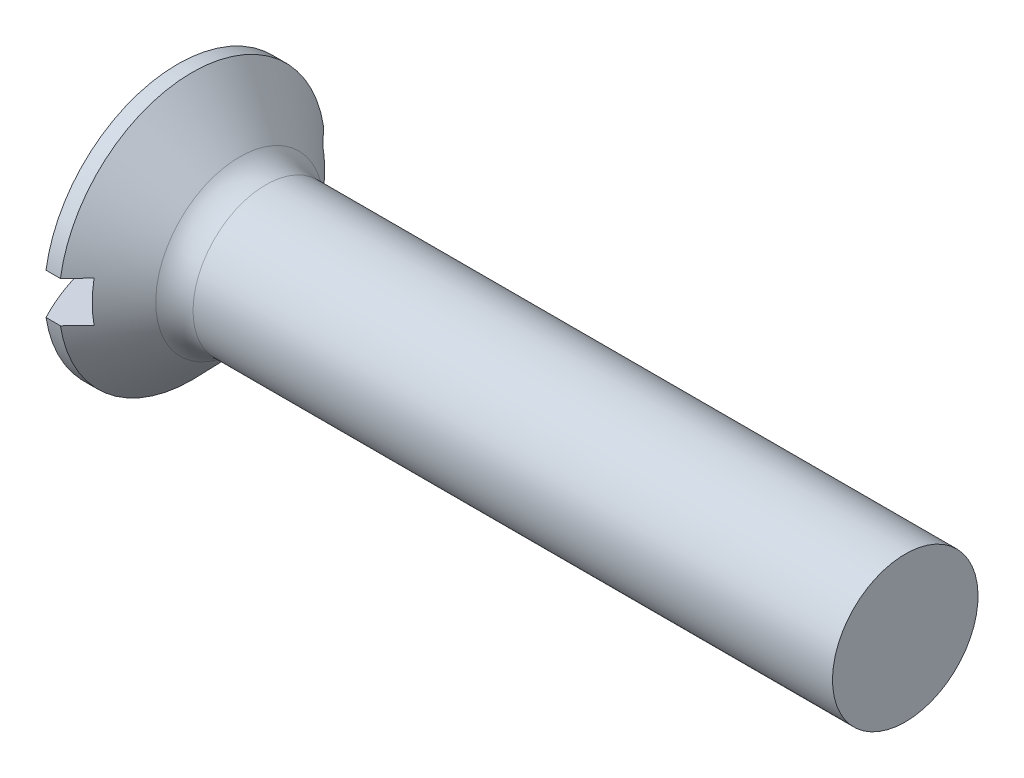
SolidWorks part; units mm, degrees
ref_plane "Front Plane" through (0, 0, 0) normal (0, 0, 1) x (1, 0, 0)
ref_plane "Top Plane" through (0, 0, 0) normal (0, 1, 0) x (1, 0, 0)
ref_plane "Right Plane" through (0, 0, 0) normal (1, 0, 0) x (0, 0, -1)
other "Configuration Table"
sketch "BodySke" plane through (0, 0, 0) normal (0, 0, 1) x (1, 0, 0)
  line L0 (2.28, 0) -> (111.3824, 0) construction
  line L1 (2.28, 0) -> (2.28, 9.15) construction
  line L2 (2.28, 9.15) -> (3.2724, 9.15)
  line L3 (3.2724, 9.15) -> (7.28, 5)
  line L4 (7.28, 5) -> (52.28, 5)
  line L5 (52.28, 5) -> (52.28, 0)
  line L6 (8.78, 8.824) -> (8.78, -5.8939) construction
  line L7 (2.28, 0) -> (52.28, 0)
  line L8 (10.28, 8.824) -> (10.28, -4.958) construction
  line L9 (2.28, -9.15) -> (3.2724, -9.15) construction
  line L10 (3.2724, -9.15) -> (7.28, -5) construction
  line L11 (7.28, -5) -> (52.28, -5) construction
  line L12 (2.28, 0) -> (-13.4753, 0) construction
  line L13 (0, 0) -> (0, 11.6167) construction
  line L14 (2.28, 0) -> (0, 0)
  arc A0 (0, 0) -> (2.28, 9.15) centre (19.5, 0) cw
  point P10 (52.28, 4.172)
revolve "BaseBody" add sketch "BodySke" angle 360 about L0
fillet "Fillet1" radius 2.5 1 edges at (7.28, -5, 0)
sketch "SlotSke" plane through (0, 0, 0) normal (1, 0, 0) x (0, 0, -1)
  line L1 (-9.15, 1.405) -> (9.15, 1.405)
  line L2 (-9.15, 1.405) -> (-9.15, -1.405)
  line L3 (-9.15, -1.405) -> (9.15, -1.405)
  line L4 (9.15, 1.405) -> (9.15, -1.405)
extrude "Slot" cut sketch "SlotSke" along normal blind 4.4
sketch "ThdSchSke" plane through (0, 0, 0) normal (0, 0, 1) x (1, 0, 0)
  line L0 (0, 0) -> (55.1256, 0) construction
  line L1 (2.28, 0) -> (111.3824, 0) construction
  line L2 (51.802, 5) -> (51.802, 5.9561)
  line L3 (51.802, 5.9561) -> (52.7581, 5.9561)
  line L4 (52.7581, 5.9561) -> (52.7581, 5)
  line L5 (52.7581, 5) -> (52.28, 4.172)
  line L6 (52.28, 4.172) -> (51.802, 5)
  line L7 (7.28, 5) -> (52.28, 5) construction
  line L13 (52.28, 5) -> (52.28, 0) construction
revolve "ThreadSchematic" [suppressed] cut sketch "ThdSchSke" angle 360 about L0
pattern_linear "ThdSchPat" [suppressed] count 29 along (1, 0, 0)
equation "\"Thread_minor@ThreadCosmetic\" = \"Thread_minor@BodySke\""
equation "\"D1@SlotSke\" = \"Head_dia@BodySke\""
equation "\"D2@SlotSke\" = \"D1@SlotSke\" / 2"
equation "\"D3@SlotSke\" = \"Slot_width@SlotSke\" / 2"
equation "\"Advance@ThdSchPat\" = \"Advance@BodySke\""
equation "\"D1@ThdSchPat\" =  int( (  \"Length@BodySke\"-\"Head_height@BodySke\"-\"Tread_runout@BodySke\" )  / \"Advance@ThdSchPat\" )+1 "
